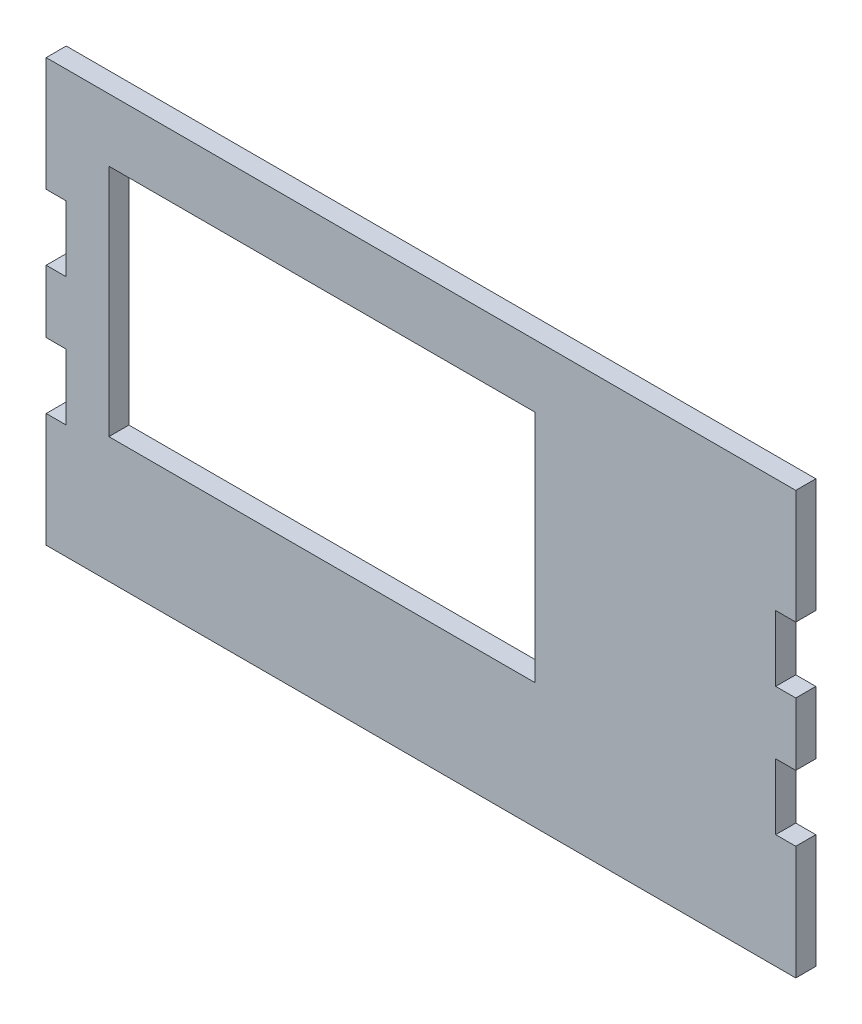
SolidWorks part; units mm, degrees
ref_plane "Front Plane" through (0, 0, 0) normal (0, 0, 1) x (1, 0, 0)
ref_plane "Top Plane" through (0, 0, 0) normal (0, 1, 0) x (1, 0, 0)
ref_plane "Right Plane" through (0, 0, 0) normal (1, 0, 0) x (0, 0, -1)
sketch "Sketch1" plane through (0, 0, 0) normal (0, 0, 1) x (1, 0, 0)
  line L0 (0, 177.4) -> (0, 229.8)
  line L1 (581.8, -16) -> (-16, -16)
  line L2 (0, 75) -> (0, 127.4)
  line L3 (170, 320.8) -> (270, 320.8)
  line L4 (565.8, 75) -> (565.8, 127.4)
  line L7 (-16, 304.8) -> (-16, 320.8)
  line L8 (0, 320.8) -> (170, 320.8)
  line L11 (581.8, 304.8) -> (581.8, 320.8)
  line L12 (565.8, 177.4) -> (565.8, 229.8)
  line L15 (-16, 320.8) -> (0, 320.8)
  line L18 (270, 320.8) -> (581.8, 320.8)
  line L20 (-16, 257.3545) -> (34, 257.3545) construction
  line L21 (34, 320.8) -> (34, 270.8) construction
  line L22 (565.8, 229.8) -> (581.8, 229.8)
  line L23 (581.8, 304.8) -> (581.8, 229.8)
  line L24 (581.8, -16) -> (581.8, 75)
  line L25 (565.8, 75) -> (581.8, 75)
  line L26 (34, -16) -> (34, 84) construction
  line L28 (-16, 177.4) -> (-16, 127.4)
  line L29 (0, 127.4) -> (-16, 127.4)
  line L30 (34, 270.8) -> (374, 270.8)
  line L31 (565.8, 177.4) -> (581.8, 177.4)
  line L32 (34, 270.8) -> (34, 84)
  line L33 (565.8, 127.4) -> (581.8, 127.4)
  line L34 (581.8, 177.4) -> (581.8, 127.4)
  line L35 (0, 177.4) -> (-16, 177.4)
  line L36 (-16, 304.8) -> (-16, 229.8)
  line L37 (0, 229.8) -> (-16, 229.8)
  line L38 (34, 84) -> (374, 84)
  line L39 (374, 270.8) -> (374, 84)
  line L43 (0, 75) -> (-16, 75)
  line L44 (-16, -16) -> (-16, 75)
extrude "Boss-Extrude1" add sketch "Sketch1" along normal blind 16 contours L24 L25 L4 L33 L34 L31 L12 L22 L23 L11 L18 L3 L8 L15 L7 L36 L37 L0 L35 L28 L29 L2 L43 L44 L1 | L39 L38 L32 L30
equation "\"thk\"= 16mm"
equation "\"D13@Sketch1\"=\"thk\""
equation "\"D15@Sketch1\"=\"thk\""
equation "\"D16@Sketch1\"=\"thk\""
equation "\"D17@Sketch1\"=\"thk\""
equation "\"D1@Boss-Extrude1\"=\"thk\""
